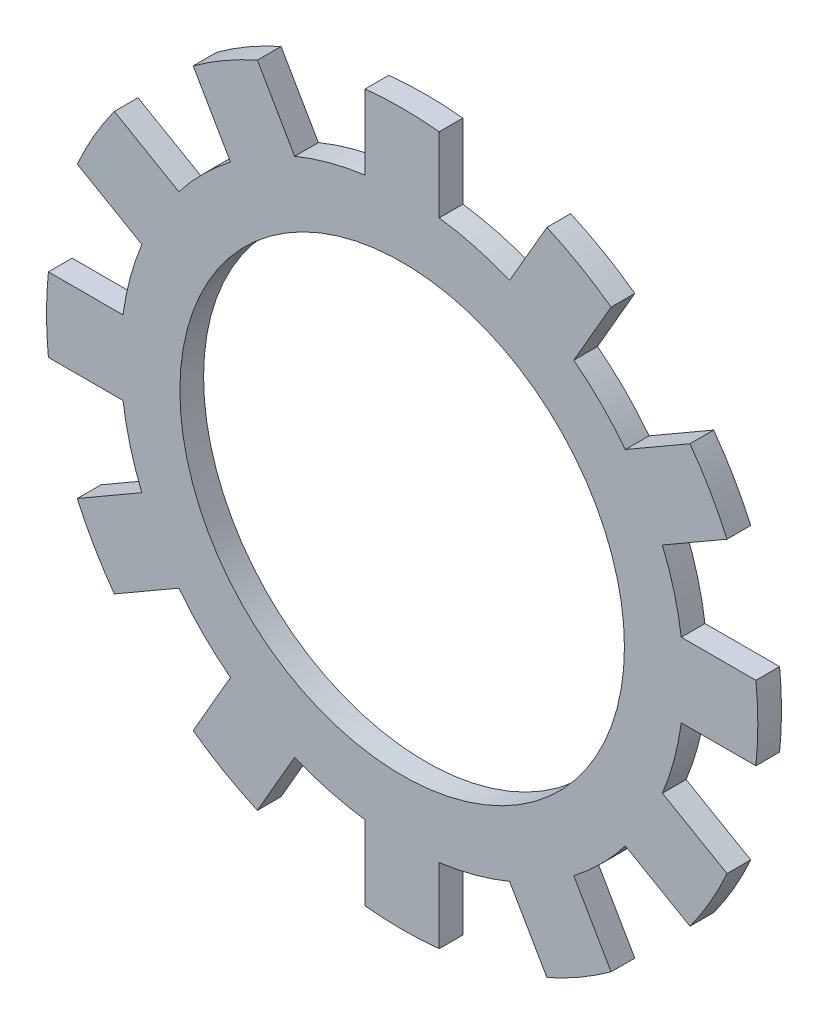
SolidWorks part; units mm, degrees
ref_plane "Front Plane" through (0, 0, 0) normal (0, 0, 1) x (1, 0, 0)
ref_plane "Top Plane" through (0, 0, 0) normal (0, 1, 0) x (1, 0, 0)
ref_plane "Right Plane" through (0, 0, 0) normal (1, 0, 0) x (0, 0, -1)
sketch "Sketch1" plane through (0, 0, 0) normal (0, 0, 1) x (1, 0, 0)
  circle A0 centre (0, 0) radius 15
  circle A1 centre (0, 0) radius 19
  dimension "D1" = 30
  dimension "D2" = 38
extrude "Boss-Extrude1" add sketch "Sketch1" along normal mid plane 1.6
sketch "Sketch2" plane through (0, 0, 0) normal (0, 0, 1) x (1, 0, 0)
  line L0 (0, 2.6811) -> (0, -2.8425) construction
sketch "Sketch3" plane through (0, 0, 0) normal (0, 0, 1) x (1, 0, 0)
  line L0 (-2.5, 23.8694) -> (-2.5, 18.8348)
  line L2 (0, 2.6811) -> (0, -2.8425) construction
  line L3 (0, 19) -> (0, 24)
  arc A0 (0, 24) -> (-2.5, 23.8694) centre (0, 0) ccw
  arc A1 (0, 19) -> (-2.5, 18.8348) centre (0, 0) ccw
  circle A2 centre (0, 0) radius 19 construction
  dimension "D2" = 24
  dimension "D1" = 2.5
extrude "Boss-Extrude2" add sketch "Sketch3" along normal mid plane 1.6
mirror "Mirror1" about plane through (0, 0, 0) normal (1, 0, 0) of "Boss-Extrude2"
pattern_circular "CirPattern2" count 12 over 360 about axis through (0, 0, 0) along (0, 0, 1) of "Boss-Extrude2", "Mirror1"
